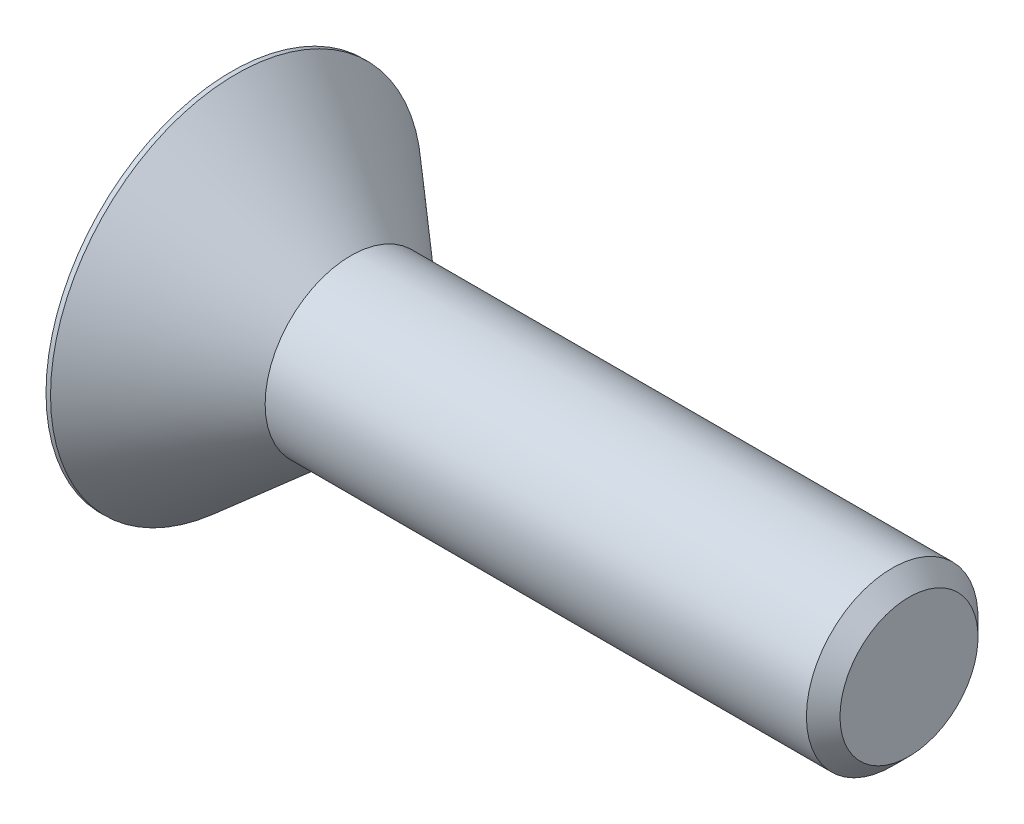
SolidWorks part; units mm, degrees
ref_plane "Plane1" through (0, 0, 0) normal (0, 0, 1) x (1, 0, 0)
ref_plane "Plane2" through (0, 0, 0) normal (0, 1, 0) x (1, 0, 0)
ref_plane "Plane3" through (0, 0, 0) normal (1, 0, 0) x (0, 0, -1)
sketch "BodySke" plane through (0, 0, 0) normal (0, 0, 1) x (1, 0, 0)
  line L0 (0, 0) -> (0, 5.2197)
  line L1 (0.127, 5.2197) -> (3.3557, 2.413)
  line L2 (0, 5.2197) -> (0.127, 5.2197)
  line L3 (3.3557, 2.413) -> (18.5776, 2.413)
  line L4 (19.05, 1.9406) -> (19.05, 0)
  line L5 (19.05, 0) -> (0, 0)
  line L6 (0, 0) -> (127, 0) construction
  line L7 (0.127, -5.2197) -> (3.3557, -2.413) construction
  line L8 (19.05, 1.9406) -> (18.5776, 2.413)
  line L9 (0, -5.2197) -> (0.127, -5.2197) construction
  line L10 (19.05, -1.9406) -> (18.5776, -2.413) construction
  line L11 (4.1482, 8.763) -> (4.1482, -13.462) construction
  line L12 (0, 19.05) -> (0, -3.175) construction
  dimension "D1" = 0.127
  dimension "Diameter" = 4.826
  dimension "Length" = 19.05
  dimension "Body_ch_ang" = 45
  dimension "Head_dia" = 10.4394
  dimension "Minor_dia" = 3.8811
  dimension "Head_ang" = 82
  dimension "Advance" = 0.7925
  dimension "Thread_nom" = 19.05
revolve "BaseBody" add sketch "BodySke" angle 360 about L6
sketch "Sketch2" plane through (0, 0, 0) normal (0, 0, 1) x (1, 0, 0)
  line L0 (0, 1.5875) -> (2.2098, 1.5875)
  line L1 (2.2098, 1.5875) -> (3.1263, 0)
  line L2 (0, 0) -> (127, 0) construction
  line L3 (3.1263, 0) -> (0, 0)
  line L4 (0, 0) -> (0, 1.5875)
  line L5 (0, -1.5875) -> (2.2098, -1.5875) construction
  line L6 (0, 0) -> (47.625, 0) construction
  line L8 (0, 5.2197) -> (0, -5.2197) construction
  dimension "D2" = 60
  dimension "PreBroach_depth" = 2.2098
  dimension "PreBroach_dia" = 3.175
revolve "PreBroach" cut sketch "Sketch2" angle 360 about L6
sketch "Sketch3" plane through (0, 0, 0) normal (-1, 0, 0) x (0, 0, 1)
  line L0 (-1.5875, -0.9165) -> (-1.5875, 0.9165)
  line L1 (-1.5875, 0.9165) -> (0, 1.8331)
  line L2 (0, 1.8331) -> (1.5875, 0.9165)
  line L3 (1.5875, 0.9165) -> (1.5875, -0.9165)
  line L4 (1.5875, -0.9165) -> (0, -1.8331)
  line L5 (0, -1.8331) -> (-1.5875, -0.9165)
  dimension "D1" = 1.5875
  dimension "D2" = 1.5875
  dimension "D3" = 3.175
  dimension "Hex_size" = 3.175
extrude "Hex" cut sketch "Sketch3" against normal blind 2.2098
equation "\"Thread_minor@ThreadCosmetic\"  =  \"Minor_dia@BodySke\""
equation "\"D1@Sketch3\" = \"Hex_size@Sketch3\" / 2"
equation "\"D2@Sketch3\" = \"D1@Sketch3\""
equation "\"D3@Sketch3\" = \"Hex_size@Sketch3\""
equation "\"Thread_length@ThreadCosmetic\" = ((sgn( (\"Length@BodySke\" - \"Advance@BodySke\" - ( ( ( \"Head_dia@BodySke\" - \"Diameter@BodySke\" ) * 0.5 ) / tan( \"Head_ang@BodySke\" * 0.008726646 ) ) ) - \"Thread_nom@Body"
